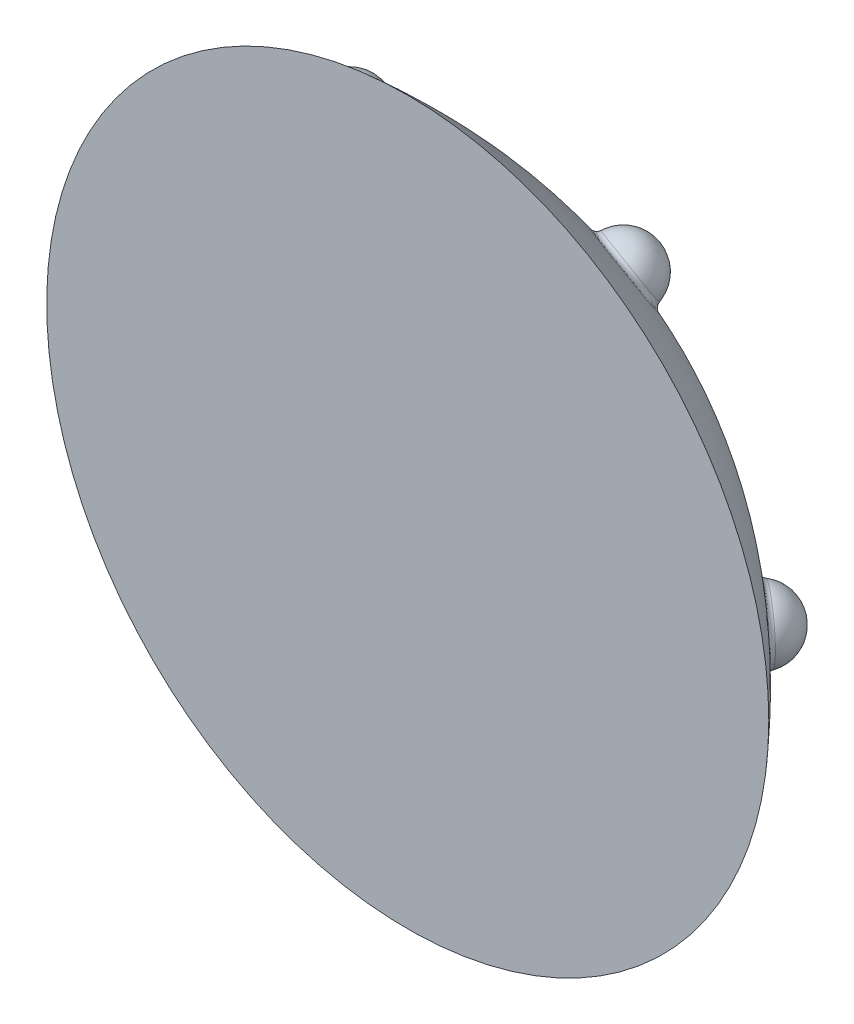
SolidWorks part; units mm, degrees
ref_plane "Front Plane" through (0, 0, 0) normal (0, 0, 1) x (1, 0, 0)
ref_plane "Top Plane" through (0, 0, 0) normal (0, 1, 0) x (1, 0, 0)
ref_plane "Right Plane" through (0, 0, 0) normal (1, 0, 0) x (0, 0, -1)
body saved out of another part "ECOSTEM-3D BLADE-HUB BASE PART"
sketch "Sketch2" plane through (0, 0, 0) normal (0, 1, 0) x (1, 0, 0)
  line L0 (-10.4542, 38.4317) -> (-10.4542, 40.6891) construction
  line L2 (-11.4939, 39.9676) -> (-9.4146, 41.4265) construction
  line L3 (-9.4146, 41.4265) -> (-11.4939, 39.9676)
  arc A0 (-9.4146, 41.4265) -> (-11.4939, 39.9676) centre (-10.4542, 40.6971) ccw
  spline S0 degree 3 poles (0, 44.45) (-5.9685, 44.45) (-10.3796, 41.5114) (-13.7795, 37.6936) knots 0 0 0 0 0.276625 0.276625 0.276625 0.276625 construction
  dimension "D1" = 1.27
revolve "Revolve1" add sketch "Sketch2" angle 360 about L2
fillet "Fillet5" radius 0.254 1 edges at (-11.4667, 0.2918, -39.9881)
pattern_circular "CirPattern1" count 6 over 360 of "Fillet5", "Revolve1"
